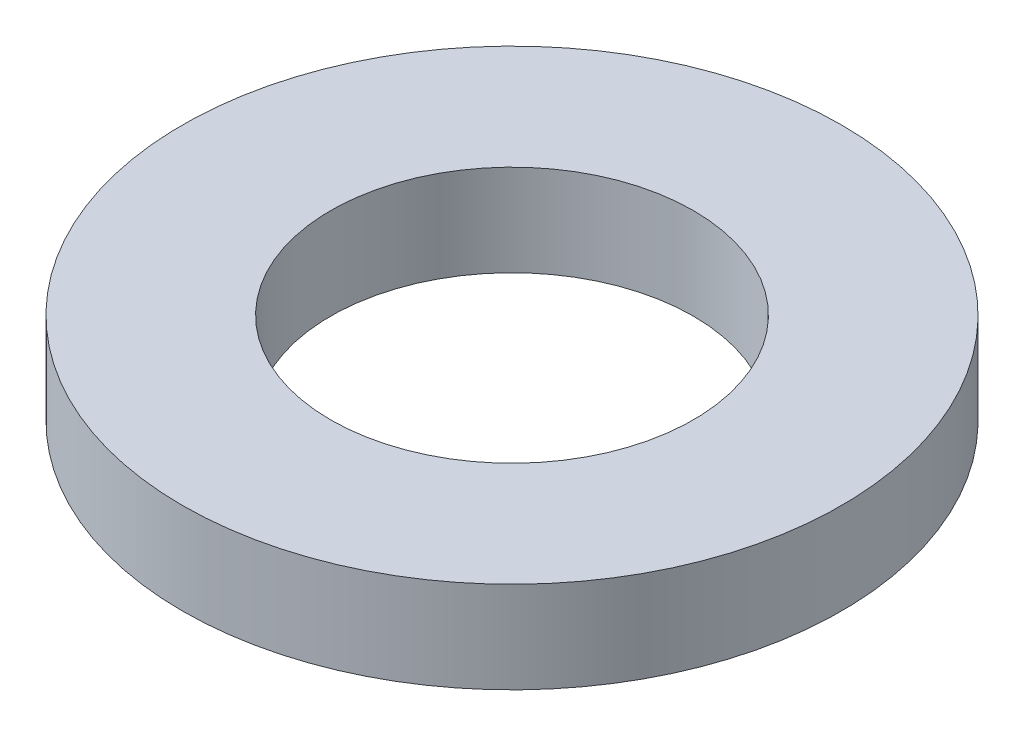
SolidWorks part; units mm, degrees
ref_plane "Front" through (0, 0, 0) normal (0, 0, 1) x (1, 0, 0)
ref_plane "Top" through (0, 0, 0) normal (0, 1, 0) x (1, 0, 0)
ref_plane "Right" through (0, 0, 0) normal (1, 0, 0) x (0, 0, -1)
sketch "Sketch1" plane through (0, 0, 0) normal (0, 1, 0) x (1, 0, 0)
  circle A0 centre (0, 0) radius 2.6543
  circle A1 centre (0, 0) radius 1.4605
  dimension "D1" = 2.921
  dimension "D2" = 5.3086
extrude "Extrude1" add sketch "Sketch1" along normal blind 0.7366
